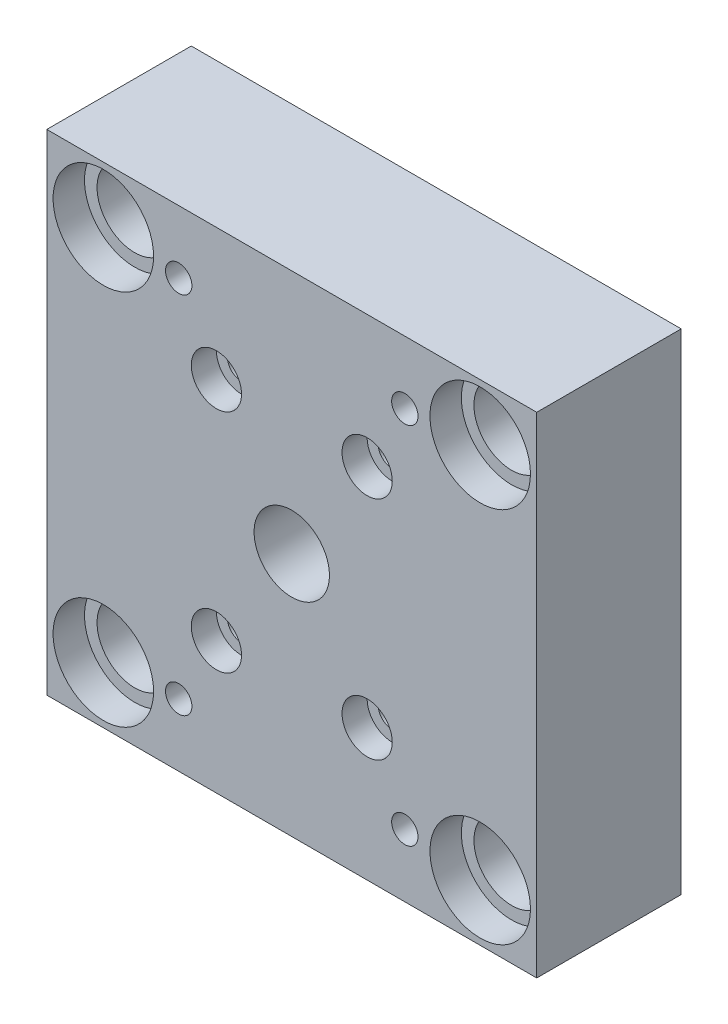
SolidWorks part; units mm, degrees
ref_plane "Face" through (0, 0, 0) normal (0, 0, 1) x (1, 0, 0)
ref_plane "Dessus" through (0, 0, 0) normal (0, 1, 0) x (1, 0, 0)
ref_plane "Droite" through (0, 0, 0) normal (1, 0, 0) x (0, 0, -1)
sketch "Esquisse1" plane through (0, 0, 0) normal (0, 0, 1) x (1, 0, 0)
  line L0 (-26.3878, 0) -> (22.5072, 0) construction
  line L1 (-39, 39) -> (39, 39)
  line L2 (-39, 39) -> (-39, -39)
  line L3 (-39, -39) -> (39, -39)
  line L4 (39, 39) -> (39, -39)
  line L5 (0, 22.7013) -> (0, -20.761) construction
  dimension "D1" = 78
  dimension "D2" = 78
extrude "Extrusion1" add sketch "Esquisse1" along normal blind 23
sketch "Esquisse5" plane through (0, 0, 23) normal (0, 0, 1) x (1, 0, 0)
  line L0 (-9.8137, 0) -> (9.3464, 0) construction
  line L1 (0, 9.7358) -> (0, -8.8012) construction
  circle A0 centre (-30, 30) radius 6
  circle A1 centre (30, 30) radius 6
  circle A2 centre (30, -30) radius 6
  circle A3 centre (-30, -30) radius 6
  dimension "D1" = 12
  dimension "D2" = 60
  dimension "D3" = 60
extrude "Enlèv. mat.-Extru.1" cut sketch "Esquisse5" against normal through all
sketch "Esquisse6" plane through (0, 0, 23) normal (0, 0, 1) x (1, 0, 0)
  circle A0 centre (30, 30) radius 8
  circle A1 centre (-30, 30) radius 8
  circle A2 centre (-30, -30) radius 8
  circle A3 centre (30, -30) radius 8
  dimension "D1" = 16
extrude "Enlèv. mat.-Extru.2" cut sketch "Esquisse6" against normal blind 5
hole_wizard "Trou taraudé M5x0.81" positions "Esquisse8" profile "Esquisse7" tap size "M5x0.8" standard "ISO"
sketch "Esquisse8" plane through (0, 0, 23) normal (0, 0, 1) x (1, 0, 0)
  line L0 (-8.198, 0) -> (7.9486, 0) construction
  line L1 (0, 7.6112) -> (0, -6.4829) construction
  point P0 (18, 29)
  point P1 (-18, 29)
  point P2 (-18, -29)
  point P3 (18, -29)
  dimension "D1" = 58
  dimension "D2" = 36
sketch "Esquisse7" plane through (18, 29, 23) normal (1, 0, 0) x (0, -1, 0)
  line L0 (0, 0) -> (0, 15.2618)
  line L1 (0, 15.2618) -> (2.1, 14)
  line L2 (2.1, 14) -> (2.1, 0)
  line L5 (2.1, 0) -> (0, 0)
  line L10 (0, 15.2618) -> (-2.1, 14) construction
  line L11 (0, -6.35) -> (0, 107.95) construction
  dimension "Diamètre du trou pour taraudage" = 4.2
  dimension "Profondeur du trou pour taraudage" = 14
  dimension "Angle de pointe" = 118
sketch "Esquisse9" plane through (0, 0, 23) normal (0, 0, 1) x (1, 0, 0)
  circle A0 centre (0, 0) radius 6
  dimension "D1" = 12
extrude "Enlèv. mat.-Extru.3" cut sketch "Esquisse9" against normal through all
sketch "Esquisse10" plane through (0, 0, 0) normal (0, 0, -1) x (-1, 0, 0)
  line L0 (0, 9.5122) -> (0, -10.5691) construction
  line L1 (-12, 24) -> (12, 24)
  line L2 (-18, 18) -> (-18, -18)
  line L3 (-12, -24) -> (12, -24)
  line L4 (18, 18) -> (18, -18)
  line L5 (-12.749, 0) -> (10.3709, 0) construction
  arc A0 (12, 24) -> (18, 18) centre (12, 18) cw
  arc A1 (-12, 24) -> (-18, 18) centre (-12, 18) ccw
  arc A2 (-18, -18) -> (-12, -24) centre (-12, -18) ccw
  arc A3 (12, -24) -> (18, -18) centre (12, -18) ccw
  dimension "D3" = 6
  dimension "D1" = 48
  dimension "D2" = 36
extrude "Enlèv. mat.-Extru.4" cut sketch "Esquisse10" against normal blind 12
hole_wizard "Chambrage pour vis à tête hexagonale M41" positions "Esquisse12" profile "Esquisse11" counterbore size "M4" standard "ISO"
sketch "Esquisse12" plane through (0, 0, 23) normal (0, 0, 1) x (1, 0, 0)
  line L0 (-8.7856, 0) -> (9.314, 0) construction
  line L2 (0, 9.248) -> (0, -9.7764) construction
  point P0 (12, 18)
  point P1 (-12, 18)
  point P3 (-12, -18)
  point P5 (12, -18)
  dimension "D1" = 12
  dimension "D2" = 18
sketch "Esquisse11" plane through (12, 18, 23) normal (1, 0, 0) x (0, -1, 0)
  line L0 (0, 0) -> (0, 23)
  line L1 (0, 23) -> (2.25, 23)
  line L3 (2.25, 23) -> (2.25, 4)
  line L4 (2.25, 4) -> (4, 4)
  line L5 (4, 4) -> (4, 0)
  line L7 (4, 0) -> (0, 0)
  line L11 (0, -6.35) -> (0, 107.95) construction
  dimension "Diamètre du perçage jusqu'au prochain" = 4.5
  dimension "Profondeur du perçage jusqu'au prochain" = 23
  dimension "Diamètre du chambrage" = 8
  dimension "Profondeur du chambrage" = 4
